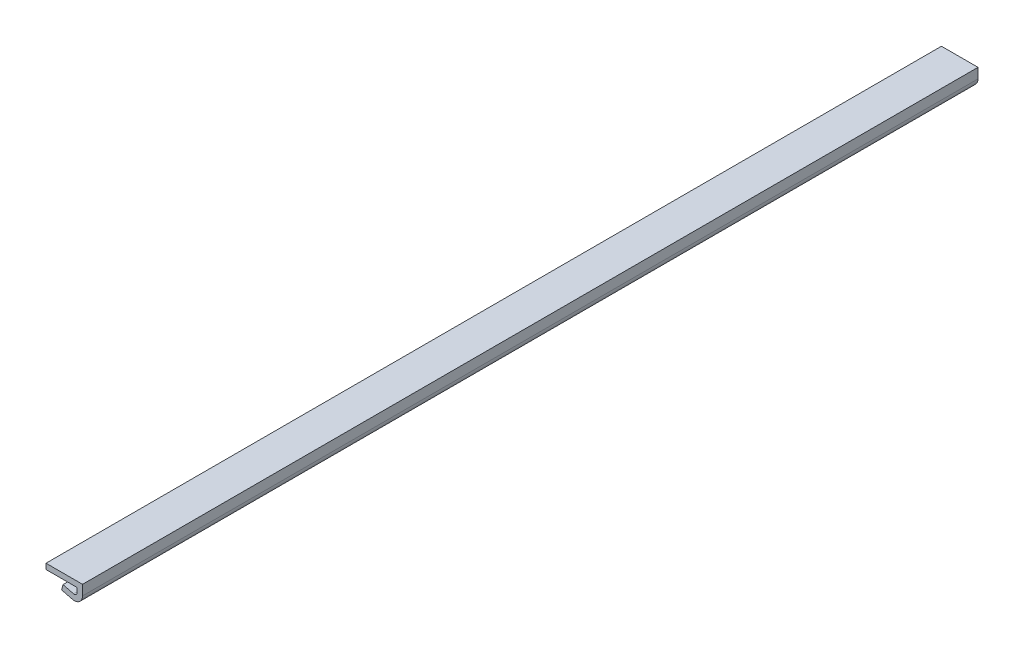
SolidWorks part; units mm, degrees
ref_plane "Plan de face" through (0, 0, 0) normal (0, 0, 1) x (1, 0, 0)
ref_plane "Plan de dessus" through (0, 0, 0) normal (0, 1, 0) x (1, 0, 0)
ref_plane "Plan de droite" through (0, 0, 0) normal (1, 0, 0) x (0, 0, -1)
sketch "Esquisse1" plane through (0, 0, 0) normal (0, 0, 1) x (1, 0, 0)
  line L0 (0, 0) -> (20, 0)
  line L1 (0, 0) -> (0, -3)
  line L2 (0, -3) -> (17, -3)
  line L3 (20, 0) -> (20, -5.5)
  line L4 (14.4114, -9.8663) -> (8.5739, -8.4109)
  line L5 (8.5739, -8.4109) -> (9.2997, -5.5)
  line L6 (9.2997, -5.5) -> (15.1371, -6.9554)
  line L7 (17, -3) -> (17, -5.5)
  arc A0 (20, -5.5) -> (14.4114, -9.8663) centre (15.5, -5.5) cw
  arc A1 (15.1371, -6.9554) -> (17, -5.5) centre (15.5, -5.5) ccw
  dimension "D5" = 1.5
  dimension "D1" = 20
  dimension "D2" = 3
  dimension "D3" = 17
  dimension "D4" = 5.5
  dimension "D6" = 76
  dimension "D7" = 2.5
extrude "Extrusion1" add sketch "Esquisse1" along normal blind 490
sketch "Esquisse2" plane through (0, 0, 490) normal (0, 0, 1) x (1, 0, 0)
  line L0 (0, 0) -> (20, 0)
  line L1 (20, 0) -> (20, -5.5)
  line L2 (14.4114, -9.8663) -> (8.5739, -8.4109)
  line L3 (8.5739, -8.4109) -> (9.2997, -5.5)
  line L4 (9.2997, -5.5) -> (15.1371, -6.9554)
  line L5 (17, -5.5) -> (17, -3)
  line L6 (17, -3) -> (0, -3)
  line L7 (0, -3) -> (0, 0)
  line L8 (-2.5369, -81) -> (22.7877, -81) construction
  arc A0 (20, -5.5) -> (14.4114, -9.8663) centre (15.5, -5.5) cw
  arc A1 (15.1371, -6.9554) -> (17, -5.5) centre (15.5, -5.5) ccw
  dimension "D1" = 78
revolve "Révolution1" [suppressed] add sketch "Esquisse2" angle 72.28 about L8
sketch "Esquisse3" [suppressed] plane through (0, 0, 0) normal (0, 0, -1) x (-1, 0, 0)
  line L0 (0, 0) -> (-20, 0)
  line L1 (-20, 0) -> (-20, -5.5)
  line L2 (-14.4114, -9.8663) -> (-8.5739, -8.4109)
  line L3 (-8.5739, -8.4109) -> (-9.2997, -5.5)
  line L4 (-9.2997, -5.5) -> (-15.1371, -6.9554)
  line L5 (-17, -5.5) -> (-17, -3)
  line L6 (-17, -3) -> (0, -3)
  line L7 (0, -3) -> (0, 0)
  line L8 (-30.2357, -81) -> (10.1051, -81) construction
  arc A0 (-20, -5.5) -> (-14.4114, -9.8663) centre (-15.5, -5.5) ccw
  arc A1 (-15.1371, -6.9554) -> (-17, -5.5) centre (-15.5, -5.5) cw
  dimension "D1" = 78
revolve "Révolution2" [suppressed] add sketch "Esquisse3" angle 72.28 about L8
